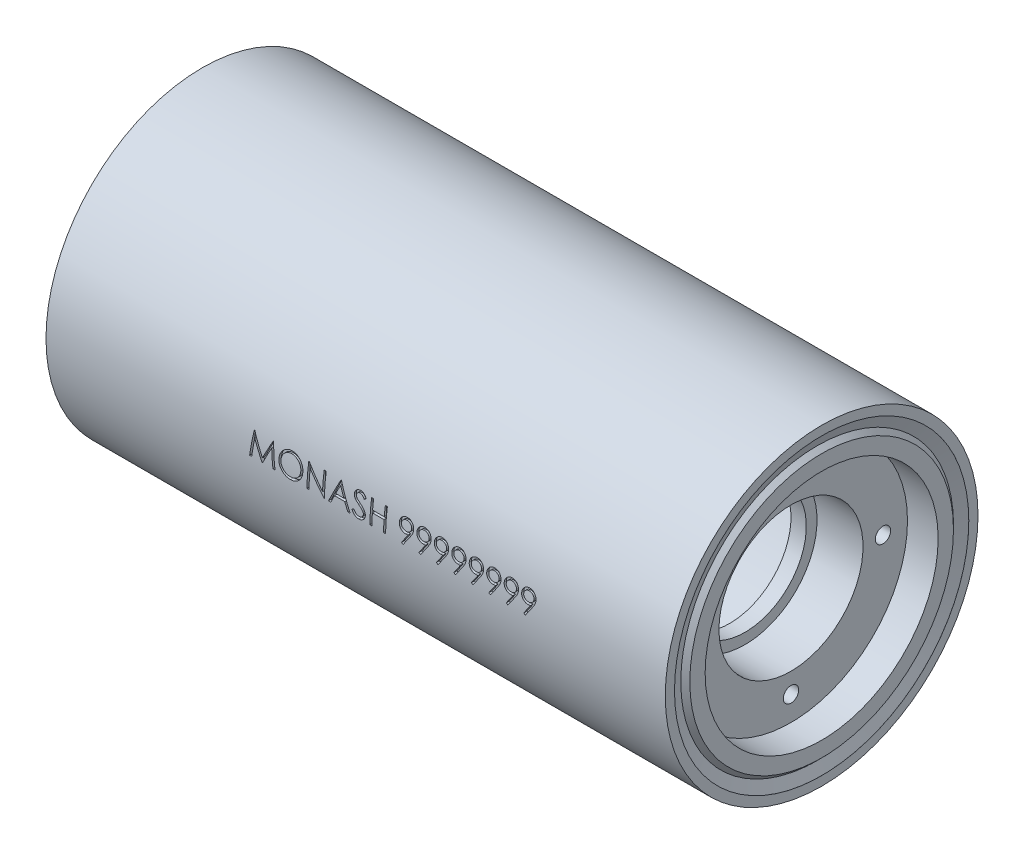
SolidWorks part; units mm, degrees
other "DetailItem1"
other "DetailItem2"
ref_plane "Front Plane" through (0, 0, 0) normal (0, 0, 1) x (1, 0, 0)
ref_plane "Top Plane" through (0, 0, 0) normal (0, 1, 0) x (1, 0, 0)
ref_plane "Right Plane" through (0, 0, 0) normal (1, 0, 0) x (0, 0, -1)
sketch "Sketch1" plane through (0, 0, 0) normal (0, 0, 1) x (1, 0, 0)
  line L0 (0, 51) -> (101, 51)
  line L1 (101, 51) -> (101, 48)
  line L3 (0, 48) -> (0, 51)
  line L4 (96, 47.99) -> (81, 47.99)
  line L5 (81, 47.99) -> (81, 37)
  line L6 (81, 37) -> (71, 37)
  line L7 (71, 37) -> (71, 20)
  line L8 (71, 20) -> (76, 20)
  line L9 (76, 20) -> (76, 23.5)
  line L10 (76, 23.5) -> (91, 23.5)
  line L11 (91, 23.5) -> (91, 38)
  line L12 (91, 38) -> (101, 38)
  line L13 (101, 38) -> (101, 43)
  line L14 (0, 0) -> (100, 0) construction
  line L15 (101, 43) -> (96, 47.99)
  line L16 (101, 48) -> (0, 48)
  dimension "D1" = 0
  dimension "D2" = 101
  dimension "D3" = 30
  dimension "D4" = 20
  dimension "D5" = 10
  dimension "D6" = 37
  dimension "D7" = 20
  dimension "D8" = 15
  dimension "D9" = 38
  dimension "D10" = 23.5
  dimension "D11" = 48
  dimension "D12" = 47.99
  dimension "D13" = 5
  dimension "D14" = 5
  dimension "D15" = 3
sketch "Sketch2" plane through (0, 0, 0) normal (0, 0, 1) x (1, 0, 0)
  line L1 (0, 51) -> (101, 51)
  line L3 (0, 48) -> (101, 48)
  line L4 (101, 51) -> (101, 48)
  line L5 (0, 48) -> (-101, 48)
  line L7 (0, 51) -> (-101, 51)
  line L8 (-101, 48) -> (-101, 51)
  dimension "D1" = 101
revolve "Revolve2" add sketch "Sketch2" angle 360 about L14
revolve "Revolve3" add sketch "Sketch1" angle 360 about L14
sketch "Sketch5" plane through (91, 0, 0) normal (1, 0, 0) x (0, 0, -1)
  line L0 (0, 23.5) -> (0, 38) construction
  circle A0 centre (0, 0) radius 30 construction
  circle A1 centre (0, 0) radius 38 construction
  circle A2 centre (0, 0) radius 23.5 construction
  dimension "D1" = 60
mirror "Mirror3" about plane through (0, 0, 0) normal (1, 0, 0)
hole_wizard "M6x1.0 Tapped Hole1" positions "Sketch7" profile "Sketch6" tap size "M6x1.0" standard "Ansi Metric"
sketch "Sketch7" plane through (91, 0, 0) normal (1, 0, 0) x (0, 0, -1)
  line L0 (0, 23.5) -> (0, 38) construction
  circle A0 centre (0, 0) radius 30 construction
  point P0 (0, 30)
  dimension "D1" = 30
sketch "Sketch6" plane through (91, 30, 0) normal (0, 1, 0) x (0, 0, -1)
  line L0 (0, 0) -> (0, 19.5022)
  line L1 (0, 19.5022) -> (2.5, 18)
  line L2 (2.5, 18) -> (2.5, 0)
  line L5 (2.5, 0) -> (0, 0)
  line L10 (0, 19.5022) -> (-2.5, 18) construction
  line L11 (0, -6.35) -> (0, 107.95) construction
  dimension "Tap Drill Dia." = 5
  dimension "Tap Drill Depth" = 18
  dimension "Drill Angle" = 118
pattern_circular "CirPattern1" count 4 over 360 about axis through (0, 0, 0) along (1, 0, 0) of "M6x1.0 Tapped Hole1"
other "Fillet Bead1" parameters "D10"=6, "D11"=5, "D12"=0, "D13"=3, "D14"=0
other "Fillet Bead2" parameters "D10"=6, "D11"=5, "D12"=0, "D13"=3, "D14"=0
ref_plane "Plane 1" through (0, 0, 51) normal (0, 0, 1) x (1, 0, 0)
sketch "Sketch10" plane through (0, 0, 51) normal (0, 0, 1) x (1, 0, 0)
  text T0 "MONASH 99999999" font "Century Gothic" height in points 28
extrude "Cut-Extrude3" cut sketch "Sketch10" against normal blind 1
hole_wizard "M6x1.0 Tapped Hole2" positions "Sketch12" profile "Sketch11" tap size "M6x1.0" standard "Ansi Metric"
sketch "Sketch12" plane through (-91, 0, 0) normal (-1, 0, 0) x (0, 0, 1)
  point P0 (0, 30)
  dimension "D1" = 0
  dimension "D2" = 30
sketch "Sketch11" plane through (-91, 30, 0) normal (0, 1, 0) x (0, 0, 1)
  line L0 (0, 0) -> (0, 19.5022)
  line L1 (0, 19.5022) -> (2.5, 18)
  line L2 (2.5, 18) -> (2.5, 0)
  line L5 (2.5, 0) -> (0, 0)
  line L10 (0, 19.5022) -> (-2.5, 18) construction
  line L11 (0, -6.35) -> (0, 107.95) construction
  dimension "Tap Drill Dia." = 5
  dimension "Tap Drill Depth" = 18
  dimension "Drill Angle" = 118
pattern_circular "CirPattern2" count 4 over 360 about axis through (0, 0, 0) along (1, 0, 0) of "M6x1.0 Tapped Hole2"
